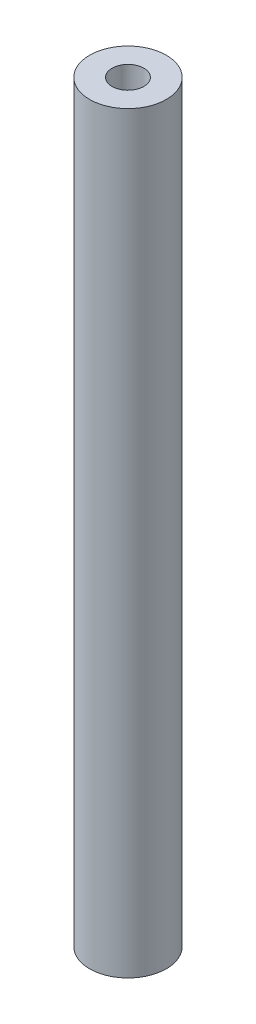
SolidWorks part; units mm, degrees
ref_plane "Front Plane" through (0, 0, 0) normal (0, 0, 1) x (1, 0, 0)
ref_plane "Top Plane" through (0, 0, 0) normal (0, 1, 0) x (1, 0, 0)
ref_plane "Right Plane" through (0, 0, 0) normal (1, 0, 0) x (0, 0, -1)
sketch "Sketch1" plane through (0, 277.5506, 0) normal (0, 1, 0) x (1, 0, 0)
  circle A1 centre (-874.1716, -1135.6033) radius 6.35
  dimension "D2" = 12.7
extrude "Boss-Extrude1" add sketch "Sketch1" along normal up to surface (124.6615 mm away)
sketch "Sketch2" plane through (0, 402.2121, 0) normal (0, 1, 0) x (1, 0, 0)
  circle A0 centre (-874.1716, -1135.6033) radius 2.6289
  circle A3 centre (-874.1716, -1135.6033) radius 6.35 construction
  dimension "D1" = 5.2578
extrude "Cut-Extrude1" cut sketch "Sketch2" against normal blind 25.4
sketch "Sketch3" plane through (0, 277.5506, 0) normal (0, -1, 0) x (1, 0, 0)
  circle A0 centre (-874.1716, 1135.6033) radius 2.6289
  circle A1 centre (-874.1716, 1135.6033) radius 6.35 construction
  dimension "D1" = 5.2578
extrude "Cut-Extrude2" cut sketch "Sketch3" against normal blind 25.4
